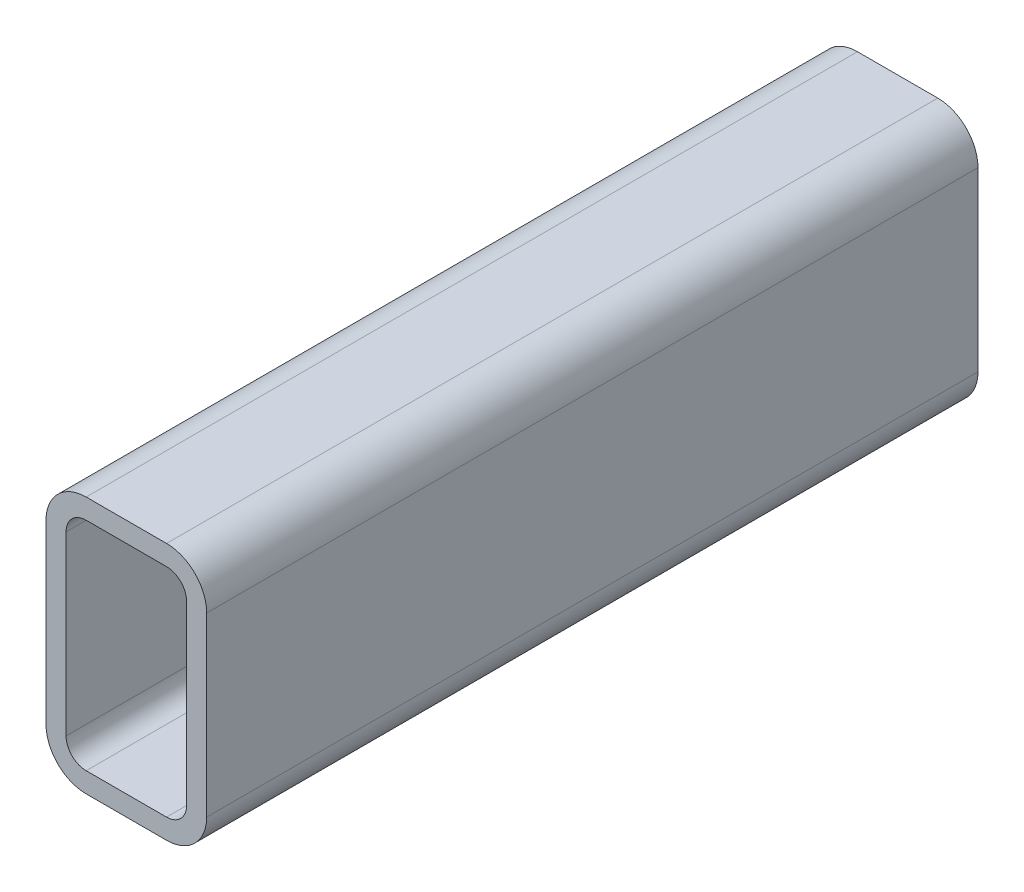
SolidWorks part; units mm, degrees
ref_plane "Front Plane" through (0, 0, 0) normal (0, 0, 1) x (1, 0, 0)
ref_plane "Top Plane" through (0, 0, 0) normal (0, 1, 0) x (1, 0, 0)
ref_plane "Right Plane" through (0, 0, 0) normal (1, 0, 0) x (0, 0, -1)
sketch "Sketch1" plane through (0, 0, 0) normal (0, 0, 1) x (1, 0, 0)
sketch_block_instance "HSS4x2.5x0.3125-1"
sketch_block "HSS4x2.5x0.3125"
extrude "Boss-Extrude1" add sketch "Sketch1" along normal blind 304.8
